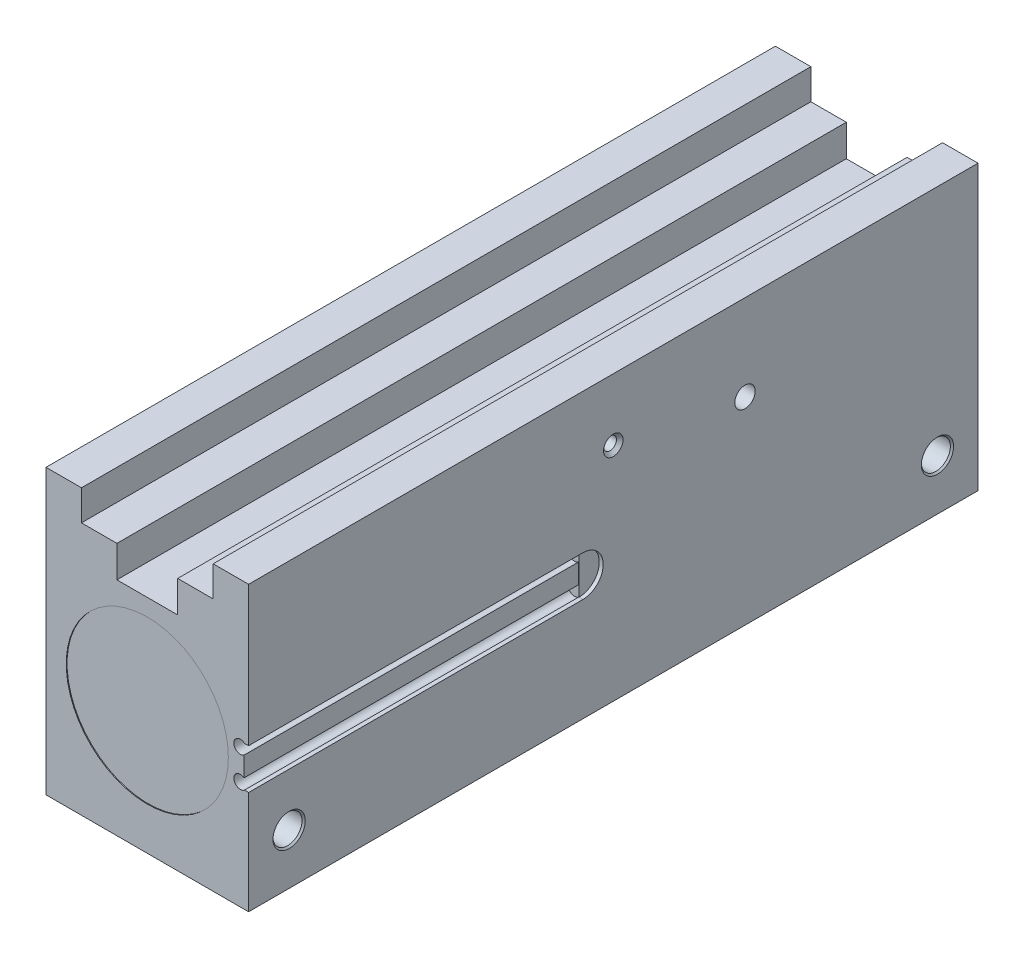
SolidWorks part; units mm, degrees
ref_plane "Front Plane" through (0, 0, 0) normal (0, 0, 1) x (1, 0, 0)
ref_plane "Top Plane" through (0, 0, 0) normal (0, 1, 0) x (1, 0, 0)
ref_plane "Right Plane" through (0, 0, 0) normal (1, 0, 0) x (0, 0, -1)
sketch "Sketch1" plane through (0, 0, 0) normal (0, 0, 1) x (1, 0, 0)
  line L1 (0, 0) -> (63.5, 0)
  line L2 (0, 0) -> (0, 88.9)
  line L3 (0, 88.9) -> (63.5, 88.9)
  line L4 (63.5, 0) -> (63.5, 88.9)
  dimension "D1" = 88.9
  dimension "D2" = 63.5
extrude "Boss-Extrude1" add sketch "Sketch1" against normal blind 228.6
sketch "Sketch2" plane through (0, 0, 0) normal (0, 0, 1) x (1, 0, 0)
  line L0 (63.5, 88.9) -> (0, 88.9) construction
  line L1 (11.1125, 88.9) -> (52.3875, 88.9)
  line L2 (11.1125, 88.9) -> (11.1125, 79.375)
  line L3 (11.1125, 79.375) -> (22.225, 79.375)
  line L4 (52.3875, 88.9) -> (52.3875, 79.375)
  line L5 (41.275, 79.375) -> (52.3875, 79.375)
  line L7 (22.225, 79.375) -> (22.225, 69.469)
  line L8 (22.225, 69.469) -> (41.275, 69.469)
  line L9 (41.275, 79.375) -> (41.275, 69.469)
  line L10 (63.5, 0) -> (63.5, 88.9) construction
  dimension "D1" = 41.275
  dimension "D2" = 19.05
  dimension "D3" = 9.525
  dimension "D4" = 11.1125
  dimension "D5" = 9.906
  dimension "D6" = 11.1125
extrude "Cut-Extrude1" cut sketch "Sketch2" against normal through all
sketch "Sketch3" plane through (0, 0, 0) normal (0, -1, 0) x (1, 0, 0)
  line L0 (0, 0) -> (63.5, 0) construction
  line L2 (0, -228.6) -> (0, 0) construction
  circle A0 centre (31.75, -38.1) radius 3.2004
  circle A1 centre (9.525, -114.3) radius 3.2004
  circle A2 centre (53.975, -114.3) radius 3.2004
  circle A3 centre (31.75, -190.5) radius 3.2004
  dimension "D1" = 6.4008
  dimension "D2" = 6.4008
  dimension "D3" = 6.4008
  dimension "D4" = 6.4008
  dimension "D6" = 114.3
  dimension "D7" = 76.2
  dimension "D8" = 76.2
  dimension "D9" = 9.525
  dimension "D10" = 31.75
  dimension "D11" = 44.45
  dimension "D12" = 31.75
  dimension "D5" = 114.3
extrude "Cut-Extrude2" cut sketch "Sketch3" against normal blind 6.35
hole_wizard "1/4-20 Tapped Hole1" positions "Sketch4" profile "Sketch5" tap size "1/4-20" standard "ANSI Inch"
sketch "Sketch4" plane through (0, 0, 0) normal (0, -1, 0) x (-1, 0, 0)
  line L0 (0, 228.6) -> (0, 0) construction
  circle A1 centre (-53.975, 114.3) radius 3.2004 construction
  point P0 (-9.525, 88.9)
  point P2 (-53.975, 88.9)
  point P4 (-53.975, 139.7)
  point P6 (-9.525, 139.6503)
  dimension "D6" = 25.4
  dimension "D1" = 9.525
  dimension "D2" = 44.45
  dimension "D3" = 50.8
  dimension "D4" = 9.525
  dimension "D5" = 50.8
  dimension "D8" = 44.45
sketch "Sketch5" plane through (9.525, 0, -88.9) normal (1, 0, 0) x (0, 0, -1)
  line L0 (0, 0) -> (0, 12.9638)
  line L1 (0, 12.9638) -> (2.5527, 11.43)
  line L2 (2.5527, 11.43) -> (2.5527, 1.2573)
  line L3 (2.5527, 1.2573) -> (3.81, 0)
  line L5 (3.81, 0) -> (0, 0)
  line L6 (-2.5527, 1.2573) -> (-3.81, 0) construction
  line L10 (0, 12.9638) -> (-2.5527, 11.43) construction
  line L11 (0, -6.35) -> (0, 107.95) construction
  dimension "Tap Drill Dia." = 5.1054
  dimension "Tap Drill Depth" = 11.43
  dimension "Near C'Sink Dia." = 7.62
  dimension "Near C'Sink Angle" = 90
  dimension "Drill Angle" = 118
sketch "Sketch6" plane through (0, 0, 0) normal (0, 0, 1) x (1, 0, 0)
  line L0 (11.1125, 88.9) -> (0, 88.9) construction
  line L1 (0, 88.9) -> (0, 0) construction
  circle A0 centre (1.143, 65.0875) radius 2.4895
  circle A1 centre (1.143, 55.5625) radius 2.7554
  dimension "D2" = 9.525
  dimension "D1" = 23.8125
  dimension "D3" = 1.143
  dimension "D4" = 1.143
extrude "Cut-Extrude3" [suppressed] cut sketch "Sketch6" against normal blind 50.8
sketch "Sketch9" plane through (0, 0, 0) normal (0, 0, 1) x (1, 0, 0)
  line L0 (0, 88.9) -> (0, 0) construction
  line L3 (0, 0) -> (63.5, 0) construction
  line L4 (63.5, 0) -> (63.5, 88.9) construction
  line L5 (62.1979, 45.085) -> (63.5, 45.085)
  line L6 (62.0776, 41.8195) -> (62.0776, 35.6505)
  line L7 (62.1979, 32.385) -> (63.5, 32.385)
  line L8 (63.5, 45.085) -> (63.5, 32.385)
  arc A0 (62.1979, 45.085) -> (62.0776, 41.8195) centre (60.9092, 43.4975) ccw
  arc A1 (62.0776, 35.6505) -> (62.1979, 32.385) centre (60.9092, 33.9725) ccw
  point P0 (31.75, 38.735)
  point P8 (0, 0)
  dimension "D3" = 4.0894
  dimension "D4" = 4.0894
  dimension "D8" = 2.5908
  dimension "D1" = 31.75
  dimension "D2" = 38.735
  dimension "D5" = 4.7625
  dimension "D6" = 4.7625
  dimension "D7" = 1.4224
extrude "Cut-Extrude4" cut sketch "Sketch9" against normal blind 104.775
sketch "Sketch10" plane through (63.5, 0, 0) normal (1, 0, 0) x (0, 0, -1)
  line L0 (104.775, 41.8195) -> (104.775, 35.6505) construction
  circle A0 centre (104.775, 38.735) radius 6.35
  dimension "D1" = 12.7
extrude "Cut-Extrude5" cut sketch "Sketch10" against normal blind 1.2319
sketch "Sketch11" plane through (0, 0, 0) normal (0, -1, 0) x (1, 0, 0)
  line L0 (0, 0) -> (63.5, 0) construction
  line L1 (0, -228.6) -> (63.5, -228.6) construction
  line L2 (0, -228.6) -> (0, 0) construction
  circle A0 centre (31.75, -12.7) radius 4.3561
  circle A1 centre (31.75, -215.9) radius 4.3561
  dimension "D1" = 8.7122
  dimension "D2" = 8.7122
  dimension "D3" = 12.7
  dimension "D4" = 12.7
  dimension "D6" = 31.75
  dimension "D5" = 31.75
hole_wizard "1/8-27 NPSM Tapped Hole2" positions "Sketch14" profile "Sketch15" tap size "1/8-27 NPSM" standard "ANSI Inch"
sketch "Sketch14" plane through (63.5, 0, 0) normal (1, 0, 0) x (0, 0, -1)
  line L0 (0, 0) -> (0, 32.385) construction
  line L1 (228.6, 0) -> (228.6, 88.9) construction
  line L2 (228.6, 0) -> (0, 0) construction
  point P0 (12.7, 15.875)
  point P2 (215.9, 15.875)
  dimension "D1" = 12.7
  dimension "D2" = 12.7
  dimension "D3" = 15.875
  dimension "D4" = 15.875
sketch "Sketch15" plane through (63.5, 15.875, -12.7) normal (0, 1, 0) x (0, 0, -1)
  line L0 (0, 0) -> (0, 25.5919)
  line L1 (0, 25.5919) -> (4.5466, 22.86)
  line L2 (4.5466, 22.86) -> (4.5466, 0.508)
  line L3 (4.5466, 0.508) -> (5.0546, 0)
  line L5 (5.0546, 0) -> (0, 0)
  line L6 (-4.5466, 0.508) -> (-5.0546, 0) construction
  line L10 (0, 25.5919) -> (-4.5466, 22.86) construction
  line L11 (0, -6.35) -> (0, 107.95) construction
  dimension "Tap Drill Dia." = 9.0932
  dimension "Tap Drill Depth" = 22.86
  dimension "Near C'Sink Dia." = 10.1092
  dimension "Near C'Sink Angle" = 90
  dimension "Drill Angle" = 118
sketch "Sketch16" plane through (63.5, 0, 0) normal (1, 0, 0) x (0, 0, -1)
  line L0 (228.6, 0) -> (228.6, 88.9) construction
  line L1 (228.6, 0) -> (0, 0) construction
  circle A0 centre (155.575, 61.976) radius 3.1941
  dimension "D1" = 6.3881
  dimension "D2" = 73.025
  dimension "D3" = 61.976
extrude "Cut-Extrude7" cut sketch "Sketch16" against normal blind 11.0998
hole_wizard "#10-32 Tapped Hole2" positions "Sketch17" profile "Sketch18" tap size "#10-32" standard "ANSI Inch"
sketch "Sketch17" plane through (63.5, 0, 0) normal (1, 0, 0) x (0, 0, -1)
  line L0 (228.6, 88.9) -> (0, 88.9) construction
  point P0 (114.3, 69.469)
  dimension "D1" = 19.431
  dimension "D2" = 114.3
sketch "Sketch18" plane through (63.5, 69.469, -114.3) normal (0, 1, 0) x (0, 0, -1)
  line L0 (0, 0) -> (0, 13.1513)
  line L1 (0, 13.1513) -> (2.0193, 11.938)
  line L2 (2.0193, 11.938) -> (2.0193, 1.0287)
  line L3 (2.0193, 1.0287) -> (3.048, 0)
  line L5 (3.048, 0) -> (0, 0)
  line L6 (-2.0193, 1.0287) -> (-3.048, 0) construction
  line L10 (0, 13.1513) -> (-2.0193, 11.938) construction
  line L11 (0, -6.35) -> (0, 107.95) construction
  dimension "Tap Drill Dia." = 4.0386
  dimension "Tap Drill Depth" = 11.938
  dimension "Near C'Sink Dia." = 6.096
  dimension "Near C'Sink Angle" = 90
  dimension "Drill Angle" = 118
sketch "Sketch19" plane through (0, 0, 0) normal (0, 0, 1) x (1, 0, 0)
  line L0 (0, 0) -> (63.5, 0) construction
  line L1 (0, 88.9) -> (0, 0) construction
  circle A0 centre (31.75, 38.735) radius 25.4
  dimension "D1" = 50.8
  dimension "D2" = 38.735
  dimension "D3" = 31.75
extrude "Cut-Extrude8" cut sketch "Sketch19" against normal blind 0.254
hole_wizard "1/8-27 NPSM Tapped Hole3" positions "Sketch20" profile "Sketch21" tap size "1/8-27 NPSM" standard "ANSI Inch"
sketch "Sketch20" plane through (0, 0, 0) normal (0, -1, 0) x (-1, 0, 0)
  line L0 (0, 0) -> (-63.5, 0) construction
  line L1 (0, 228.6) -> (-63.5, 228.6) construction
  line L2 (0, 228.6) -> (0, 0) construction
  point P0 (-31.75, 12.7)
  point P2 (-31.75, 215.9)
  point P9 (-31.75, 228.6)
  dimension "D1" = 12.7
  dimension "D2" = 12.7
  dimension "D3" = 31.75
  dimension "D4" = 31.75
sketch "Sketch21" plane through (31.75, 0, -12.7) normal (1, 0, 0) x (0, 0, -1)
  line L0 (0, 0) -> (0, 25.5919)
  line L1 (0, 25.5919) -> (4.5466, 22.86)
  line L2 (4.5466, 22.86) -> (4.5466, 0.508)
  line L3 (4.5466, 0.508) -> (5.0546, 0)
  line L5 (5.0546, 0) -> (0, 0)
  line L6 (-4.5466, 0.508) -> (-5.0546, 0) construction
  line L10 (0, 25.5919) -> (-4.5466, 22.86) construction
  line L11 (0, -6.35) -> (0, 107.95) construction
  dimension "Tap Drill Dia." = 9.0932
  dimension "Tap Drill Depth" = 22.86
  dimension "Near C'Sink Dia." = 10.1092
  dimension "Near C'Sink Angle" = 90
  dimension "Drill Angle" = 118
